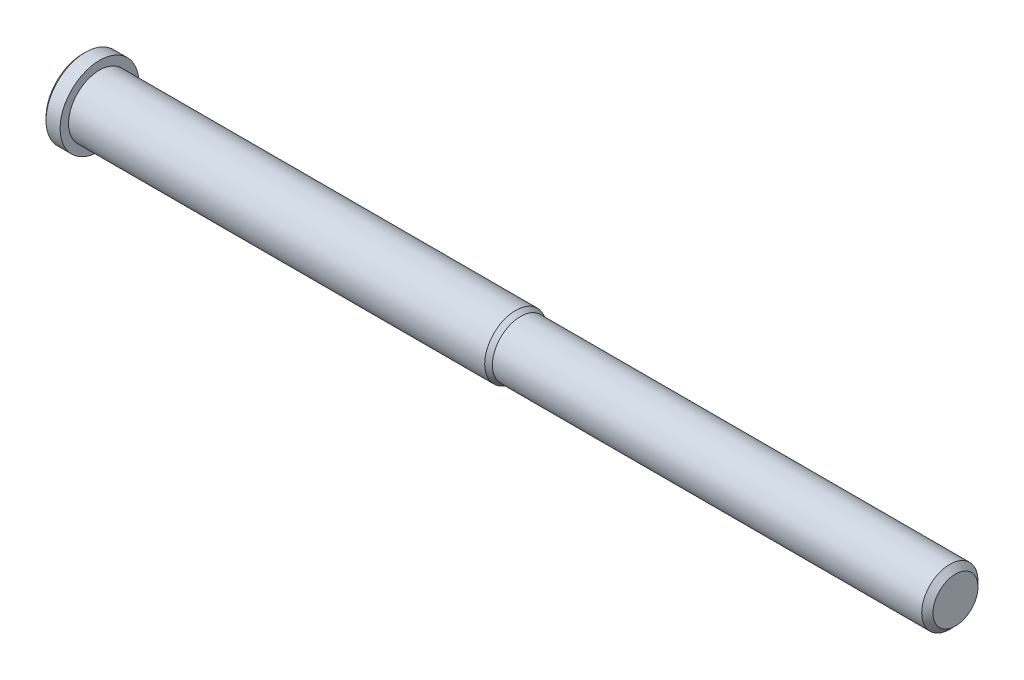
SolidWorks part; units mm, degrees
ref_plane "Plan de face" through (0, 0, 0) normal (0, 0, 1) x (1, 0, 0)
ref_plane "Plan de dessus" through (0, 0, 0) normal (0, 1, 0) x (1, 0, 0)
ref_plane "Plan de droite" through (0, 0, 0) normal (1, 0, 0) x (0, 0, -1)
sketch "Esquisse1" plane through (0, 0, 0) normal (0, 0, 1) x (1, 0, 0)
  line L0 (0, 0) -> (338.9017, 0) construction
  line L1 (0, 0) -> (0, 14)
  line L2 (0, 14) -> (6, 14)
  line L3 (6, 14) -> (6, 11)
  line L4 (6, 11) -> (153.8017, 11)
  line L5 (153.8017, 11) -> (155.5338, 10)
  line L6 (155.5338, 10) -> (310, 10)
  line L7 (310, 10) -> (310, 0)
  line L8 (310, 0) -> (0, 0)
  dimension "D1" = 10
  dimension "D2" = 150
  dimension "D3" = 11
  dimension "D4" = 14
  dimension "D5" = 304
  dimension "D6" = 310
revolve "Révolution1" add sketch "Esquisse1" angle 360 about L0
chamfer "Chanfrein1" distance 1 angle 45 1 edges at (0, 0, 14)
chamfer "Chanfrein2" distance 2 angle 45 1 edges at (310, 0, 10)
